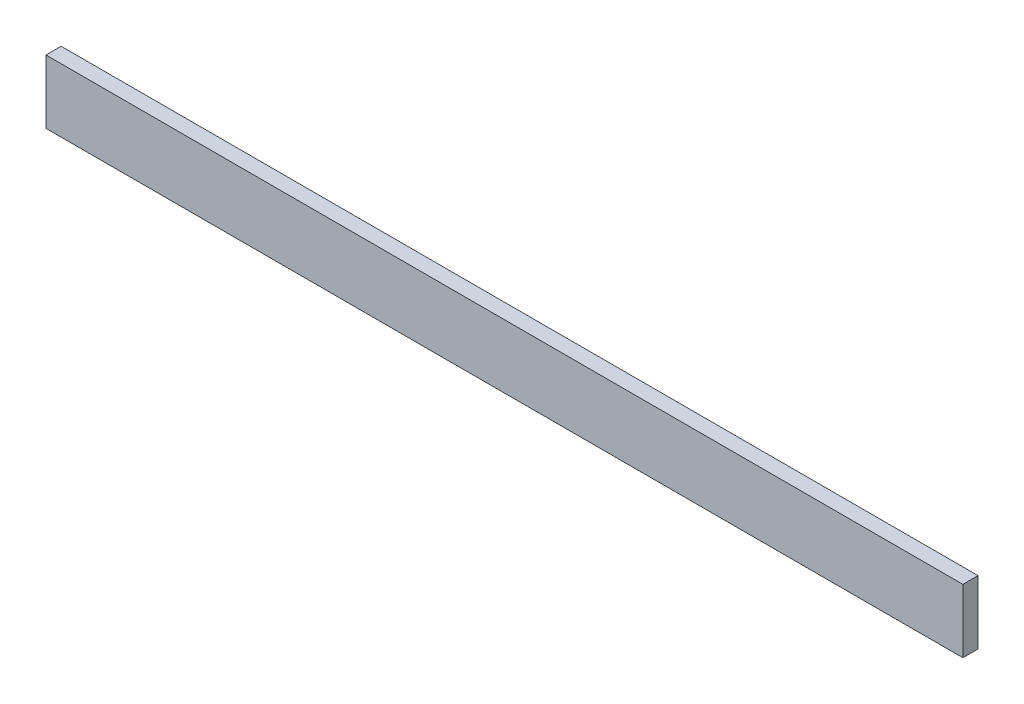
SolidWorks part; units mm, degrees
ref_plane "Front Plane" through (0, 0, 0) normal (0, 0, 1) x (1, 0, 0)
ref_plane "Top Plane" through (0, 0, 0) normal (0, 1, 0) x (1, 0, 0)
ref_plane "Right Plane" through (0, 0, 0) normal (1, 0, 0) x (0, 0, -1)
sketch "Sketch1" plane through (0, 0, 0) normal (0, 0, 1) x (1, 0, 0)
  line L1 (-78.7478, 22.158) -> (1075.0523, 22.158)
  line L2 (-78.7478, 22.158) -> (-78.7478, -57.842)
  line L3 (-78.7478, -57.842) -> (1075.0523, -57.842)
  line L4 (1075.0523, 22.158) -> (1075.0523, -57.842)
  dimension "D1" = 1153.8001
  dimension "D2" = 80
extrude "Boss-Extrude1" add sketch "Sketch1" along normal blind 19.05
